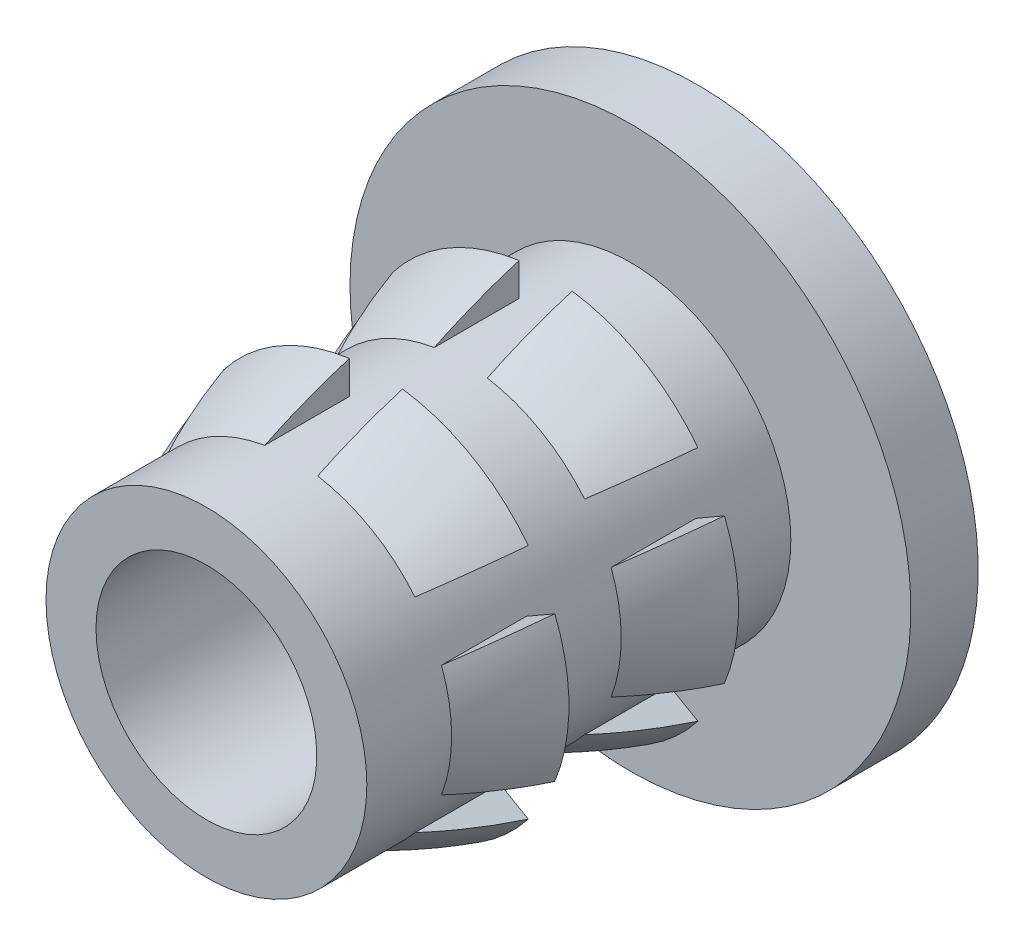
SolidWorks part; units mm, degrees
other "<flanged insert M3X0.5>-<CirPattern1>"
ref_plane "Front Plane" through (0, 0, 0) normal (0, 0, 1) x (1, 0, 0)
ref_plane "Top Plane" through (0, 0, 0) normal (0, 1, 0) x (1, 0, 0)
ref_plane "Right Plane" through (0, 0, 0) normal (1, 0, 0) x (0, 0, -1)
inserted part "flanged insert M3X0.5"
